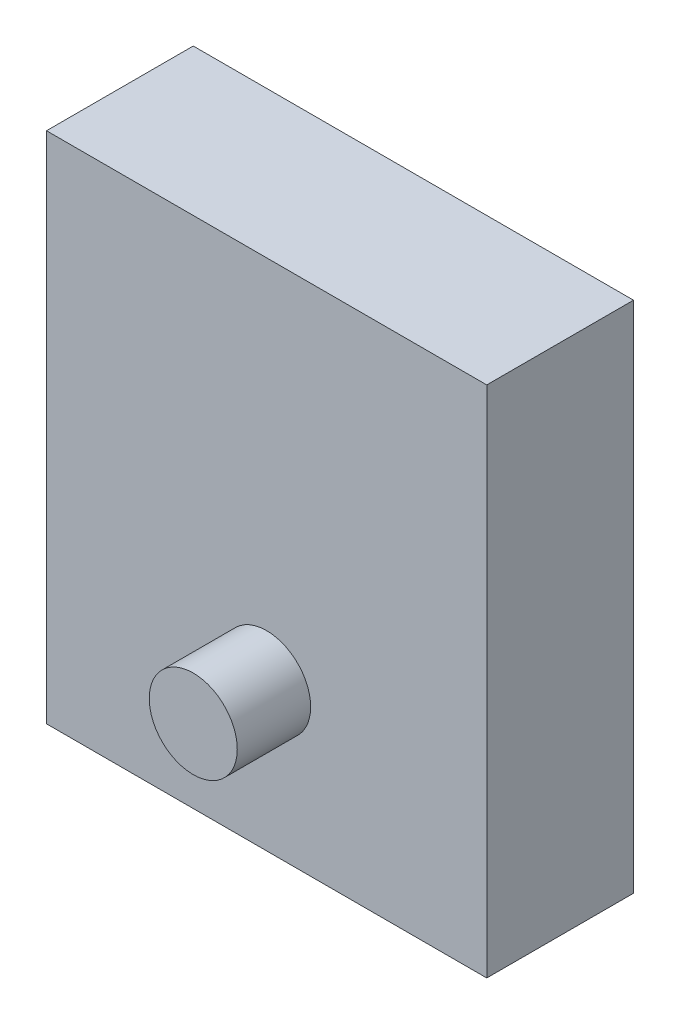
SolidWorks part; units mm, degrees
ref_plane "Front Plane" through (0, 0, 0) normal (0, 0, 1) x (1, 0, 0)
ref_plane "Top Plane" through (0, 0, 0) normal (0, 1, 0) x (1, 0, 0)
ref_plane "Right Plane" through (0, 0, 0) normal (1, 0, 0) x (0, 0, -1)
sketch "Sketch1" plane through (0, 0, 0) normal (0, 0, 1) x (1, 0, 0)
sketch_block_instance "Piston_tank-1"
sketch_block "Piston_tank" parameters "D3"=6, "D1"=30, "D2"=35
extrude "Boss-Extrude1" add sketch "Sketch1" against normal blind 10
extrude "Boss-Extrude2" add sketch "Sketch1<3>" along normal blind 5 separate body
sketch "Sketch1<3>"
